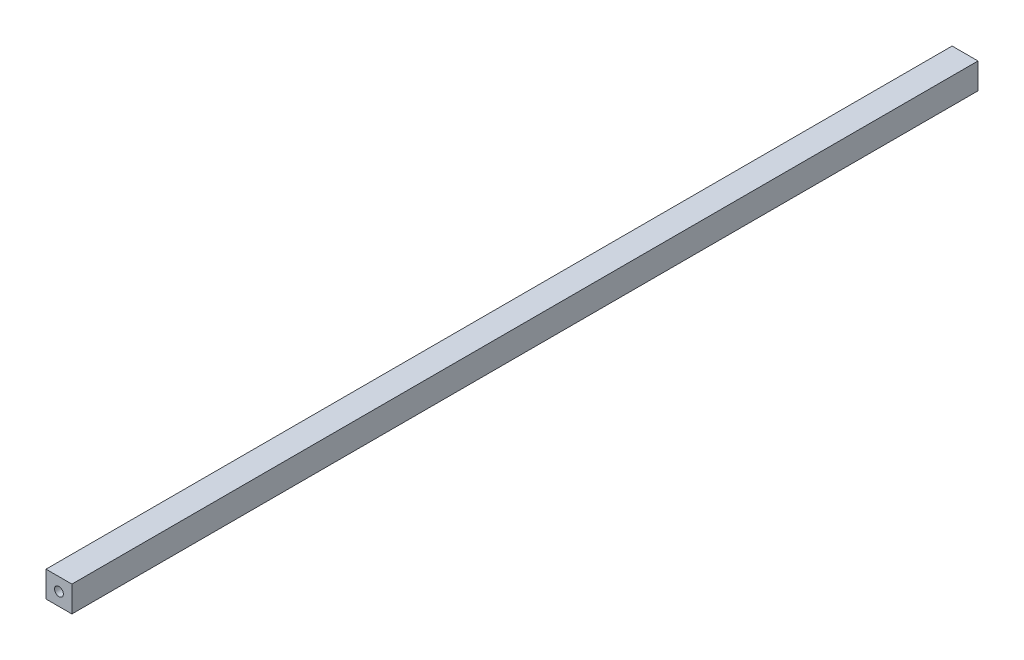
SolidWorks part; units mm, degrees
ref_plane "Plan de face" through (0, 0, 0) normal (0, 0, 1) x (1, 0, 0)
ref_plane "Plan de dessus" through (0, 0, 0) normal (0, 1, 0) x (1, 0, 0)
ref_plane "Plan de droite" through (0, 0, 0) normal (1, 0, 0) x (0, 0, -1)
sketch "Esquisse1" plane through (0, 0, 0) normal (0, 0, 1) x (1, 0, 0)
  line L0 (-10, -10) -> (10, 10) construction
  line L1 (-10, -10) -> (10, -10)
  line L2 (-10, -10) -> (-10, 10)
  line L3 (-10, 10) -> (10, 10)
  line L4 (10, -10) -> (10, 10)
  point P4 (0, 0)
  dimension "D1" = 20
  dimension "D2" = 20
extrude "Extrusion1" add sketch "Esquisse1" along normal mid plane 700
hole_wizard "Trou taraudé M8x1.251" positions "Esquisse3" profile "Esquisse2" tap size "M8x1.25" standard "ISO"
sketch "Esquisse3" plane through (0, 0, 350) normal (0, 0, 1) x (1, 0, 0)
  point P0 (0, 0)
sketch "Esquisse2" plane through (0, 0, 350) normal (1, 0, 0) x (0, -1, 0)
  line L0 (0, 0) -> (0, 22.0429)
  line L1 (0, 22.0429) -> (3.4, 20)
  line L2 (3.4, 20) -> (3.4, 0)
  line L5 (3.4, 0) -> (0, 0)
  line L10 (0, 22.0429) -> (-3.4, 20) construction
  line L11 (0, -6.35) -> (0, 107.95) construction
  dimension "Diamètre du trou pour taraudage" = 6.8
  dimension "Profondeur du trou pour taraudage" = 20
  dimension "Angle de pointe" = 118
hole_wizard "Trou taraudé M8x1.252" positions "Esquisse5" profile "Esquisse4" tap size "M8x1.25" standard "ISO"
sketch "Esquisse5" plane through (0, 0, -350) normal (0, 0, -1) x (-1, 0, 0)
  point P0 (0, 0)
sketch "Esquisse4" plane through (0, 0, -350) normal (1, 0, 0) x (0, 1, 0)
  line L0 (0, 0) -> (0, 22.0429)
  line L1 (0, 22.0429) -> (3.4, 20)
  line L2 (3.4, 20) -> (3.4, 0)
  line L5 (3.4, 0) -> (0, 0)
  line L10 (0, 22.0429) -> (-3.4, 20) construction
  line L11 (0, -6.35) -> (0, 107.95) construction
  dimension "Diamètre du trou pour taraudage" = 6.8
  dimension "Profondeur du trou pour taraudage" = 20
  dimension "Angle de pointe" = 118
